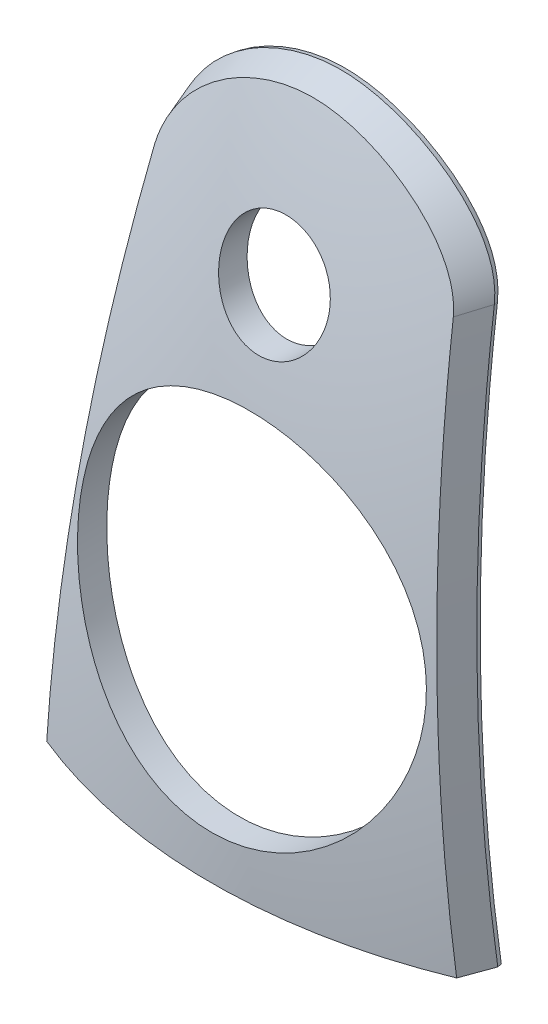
SolidWorks part; units mm, degrees
other "<Speaker_Surface_Master>-<Surface-Extend2>"
other "<Speaker_Surface_Master>-<Surface-Extend1>"
other "<Speaker_Surface_Master>-<Surface-Extend3>"
other "<Speaker_Surface_Master>-<Driver Mounts[2]>"
other "<Speaker_Surface_Master>-<Driver Mounts[1]>"
other "<Speaker_Surface_Master>-<Base>"
ref_plane "Front Plane" through (0, 0, 0) normal (0, 0, 1) x (1, 0, 0)
ref_plane "Top Plane" through (0, 0, 0) normal (0, 1, 0) x (1, 0, 0)
ref_plane "Right Plane" through (0, 0, 0) normal (1, 0, 0) x (0, 0, -1)
inserted part "Speaker_Surface_Master"
other "Intersect1"
other "Ruled Surface1" parameters "D1"=25, "D2"=20
surface "Surface-Extend1" parameters "D1"=3, "D2"=3, "D3"=3, "D4"=3, "D5"=3
move or copy body "Body-Move/Copy1" bodies to move or copy 110 copy no translate (0, 0, 3)
other "SurfaceCut1"
shell "Shell1" thickness 4
delete or keep bodies "Clean Up" type delete bodies bodies 111
